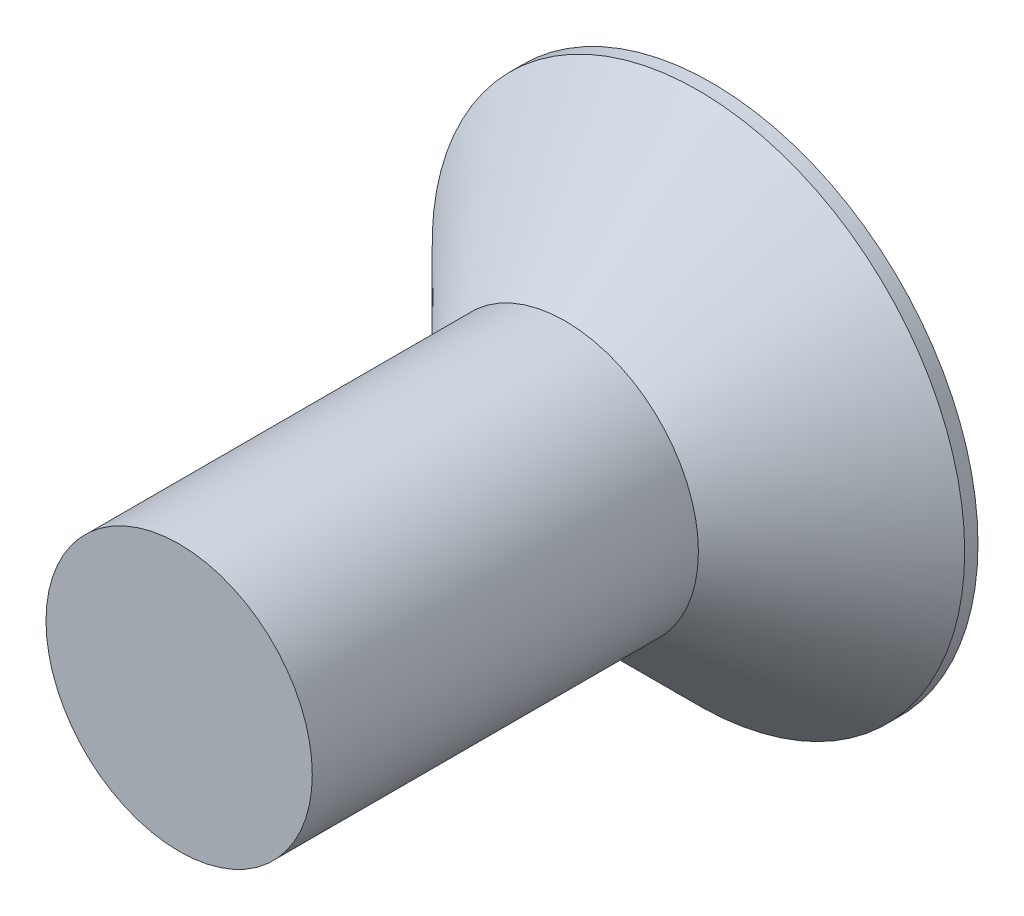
SolidWorks part; units mm, degrees
ref_plane "Front Plane" through (0, 0, 0) normal (0, 0, 1) x (1, 0, 0)
ref_plane "Top Plane" through (0, 0, 0) normal (0, 1, 0) x (1, 0, 0)
ref_plane "Right Plane" through (0, 0, 0) normal (1, 0, 0) x (0, 0, -1)
sketch "Sketch6" plane through (0, 0, 0) normal (1, 0, 0) x (0, 0, -1)
  line L0 (-16, 0) -> (22.525, 0) construction
  line L1 (7.7, 0) -> (-7.7, 0) construction
  line L2 (-16, 0) -> (-16, -4)
  line L3 (-16, -4) -> (-4.4, -4)
  line L5 (-0.4, -8) -> (0, -8)
  line L6 (-4.4, -4) -> (-0.4, -8)
  line L7 (0, -8) -> (0, 0)
  line L8 (0, 0) -> (-16, 0)
  dimension "D1" = 45
  dimension "L" = 16
  dimension "H" = 4.4
  dimension "A" = 16
  dimension "D" = 8
revolve "Revolve1" add sketch "Sketch6" angle 360 about L0
sketch "Sketch7" plane through (0, 0, 0) normal (0, 0, -1) x (-1, 0, 0)
  line L2 (-2.5, 1.4434) -> (-2.5, -1.4434)
  line L4 (-2.5, -1.4434) -> (0, -2.8868)
  line L5 (0, -2.8868) -> (2.5, -1.4434)
  line L6 (2.5, -1.4434) -> (2.5, 1.4434)
  line L7 (2.5, 1.4434) -> (0, 2.8868)
  line L8 (0, 2.8868) -> (-2.5, 1.4434)
  circle A0 centre (0, 0) radius 2.5 construction
  dimension "J" = 5
extrude "HEX" cut sketch "Sketch7" against normal blind 4
